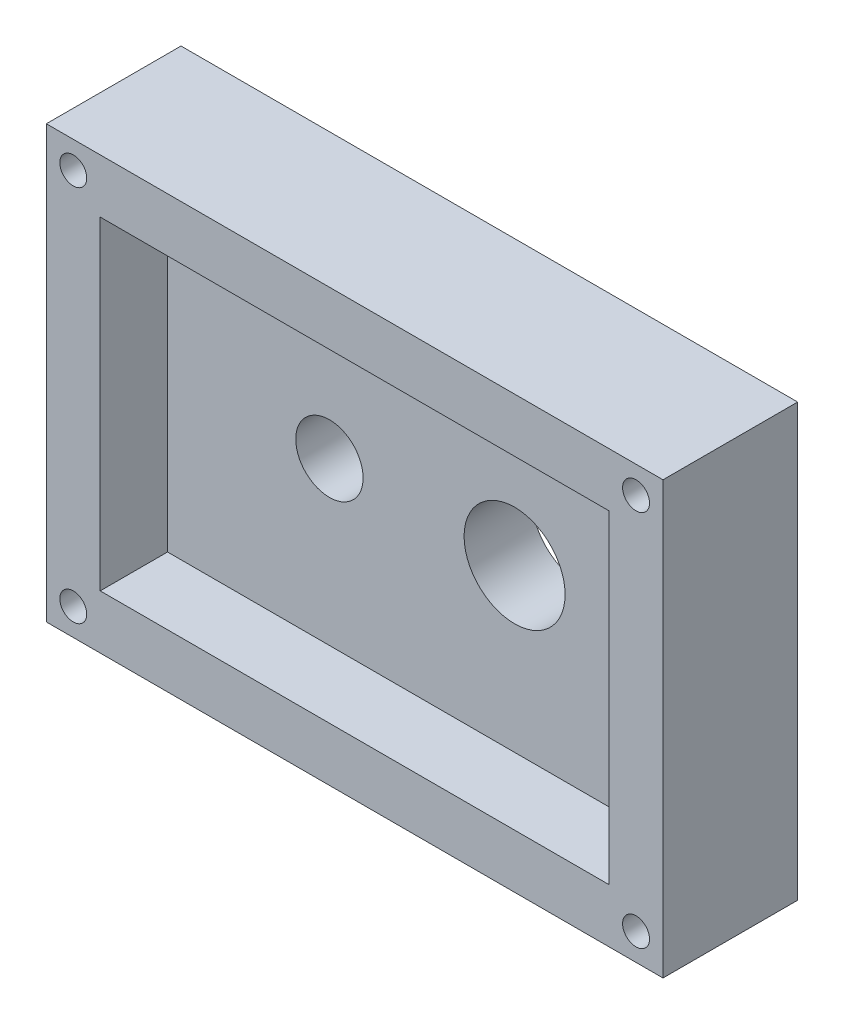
SolidWorks part; units mm, degrees
ref_plane "Front Plane" through (0, 0, 0) normal (0, 0, 1) x (1, 0, 0)
ref_plane "Top Plane" through (0, 0, 0) normal (0, 1, 0) x (1, 0, 0)
ref_plane "Right Plane" through (0, 0, 0) normal (1, 0, 0) x (0, 0, -1)
sketch "Sketch1" plane through (0, 0, 0) normal (0, 0, 1) x (1, 0, 0)
  line L1 (-29.0766, -20.3454) -> (29.0766, -20.3454)
  line L2 (-29.0766, -20.3454) -> (-29.0766, 20.3454)
  line L3 (-29.0766, 20.3454) -> (29.0766, 20.3454)
  line L4 (29.0766, -20.3454) -> (29.0766, 20.3454)
  line L5 (-29.0766, -20.3454) -> (29.0766, 20.3454) construction
  line L6 (-29.0766, 20.3454) -> (29.0766, -20.3454) construction
  point P0 (0, 0)
extrude "Boss-Extrude1" add sketch "Sketch1" against normal blind 12.7
sketch "Sketch2" plane through (0, 0, 0) normal (0, 0, 1) x (1, 0, 0)
  line L1 (-23.9966, -15.2654) -> (23.9966, -15.2654)
  line L2 (-23.9966, -15.2654) -> (-23.9966, 15.2654)
  line L3 (-23.9966, 15.2654) -> (23.9966, 15.2654)
  line L4 (23.9966, -15.2654) -> (23.9966, 15.2654)
  line L5 (-23.9966, -15.2654) -> (23.9966, 15.2654) construction
  line L6 (-23.9966, 15.2654) -> (23.9966, -15.2654) construction
  point P0 (0, 0)
extrude "Cut-Extrude1" cut sketch "Sketch2" against normal blind 6.35
sketch "Sketch3" plane through (0, 0, 0) normal (0, 0, 1) x (1, 0, 0)
  circle A0 centre (-8.7312, 0) radius 3.175
  circle A1 centre (8.7312, 0) radius 4.7625
extrude "Cut-Extrude2" cut sketch "Sketch3" against normal blind 12.7
sketch "Sketch4" plane through (0, 0, 0) normal (0, 0, 1) x (1, 0, 0)
  circle A0 centre (26.5367, 17.8054) radius 1.27
  circle A1 centre (-26.5367, 17.8054) radius 1.27
  circle A2 centre (26.5367, -17.8054) radius 1.27
  circle A3 centre (-26.5367, -17.8054) radius 1.27
extrude "Cut-Extrude3" cut sketch "Sketch4" against normal blind 12.7
equation "\"PD_p\"= 0.375in"
equation "\"PD_g\"= 1in"
equation "\"OD_g\"= 1.042in"
equation "\"CD\"= (\"PD_p\"+\"PD_g\")/2"
equation "\"c_gap\"= 0.08in"
equation "\"t_wall\"= 0.2in"
equation "\"L_cav\"= \"CD\"+\"OD_g\"+2*\"c_gap\""
equation "\"W_cav\"= \"OD_g\"+2*\"c_gap\""
equation "\"L_out\"= \"L_cav\"+2*\"t_wall\""
equation "\"W_out\"= \"W_cav\"+2*\"t_wall\""
equation "\"Z_half\"= 0.5in"
equation "\"Z_cav\"= 0.25in"
equation "\"D_boreP\"= 0.25in"
equation "\"D_boreG\"= 0.375in"
equation "\"D_bolt\"= 0.1in"
equation "\"HX\"= \"L_cav\"/2+\"t_wall\"/2"
equation "\"HY\"= \"W_cav\"/2+\"t_wall\"/2"
equation "\"D1@Sketch1@Part5.Part\"= \"L_out\""
equation "\"D2@Sketch1@Part5.Part\"= \"W_out\""
equation "\"D1@Boss-Extrude1\"= \"Z_half\""
equation "\"D1@Sketch2@Part5.Part\"= \"L_cav\""
equation "\"D2@Sketch2@Part5.Part\"= \"W_cav\""
equation "\"D1@Cut-Extrude1\"= \"Z_cav\""
equation "\"D1@Sketch3@Part5.Part\"= \"D_boreP\""
equation "\"D2@Sketch3@Part5.Part\"= \"CD\"/2"
equation "\"D3@Sketch3@Part5.Part\"= \"D_boreG\""
equation "\"D4@Sketch3@Part5.Part\"= \"CD\"/2"
equation "\"D1@Cut-Extrude2\"= \"Z_half\""
equation "\"D1@Sketch4@Part5.Part\"= \"D_bolt\""
equation "\"D2@Sketch4@Part5.Part\"= \"HX\""
equation "\"D3@Sketch4@Part5.Part\"= \"HY\""
equation "\"D4@Sketch4@Part5.Part\"= \"D_bolt\""
equation "\"D5@Sketch4@Part5.Part\"= \"HX\""
equation "\"D6@Sketch4@Part5.Part\"= \"HY\""
equation "\"D7@Sketch4@Part5.Part\"= \"D_bolt\""
equation "\"D8@Sketch4@Part5.Part\"= \"HX\""
equation "\"D9@Sketch4@Part5.Part\"= \"HY\""
equation "\"D10@Sketch4@Part5.Part\"= \"D_bolt\""
equation "\"D11@Sketch4@Part5.Part\"= \"HX\""
equation "\"D12@Sketch4@Part5.Part\"= \"HY\""
equation "\"D1@Cut-Extrude3\"= \"Z_half\""
